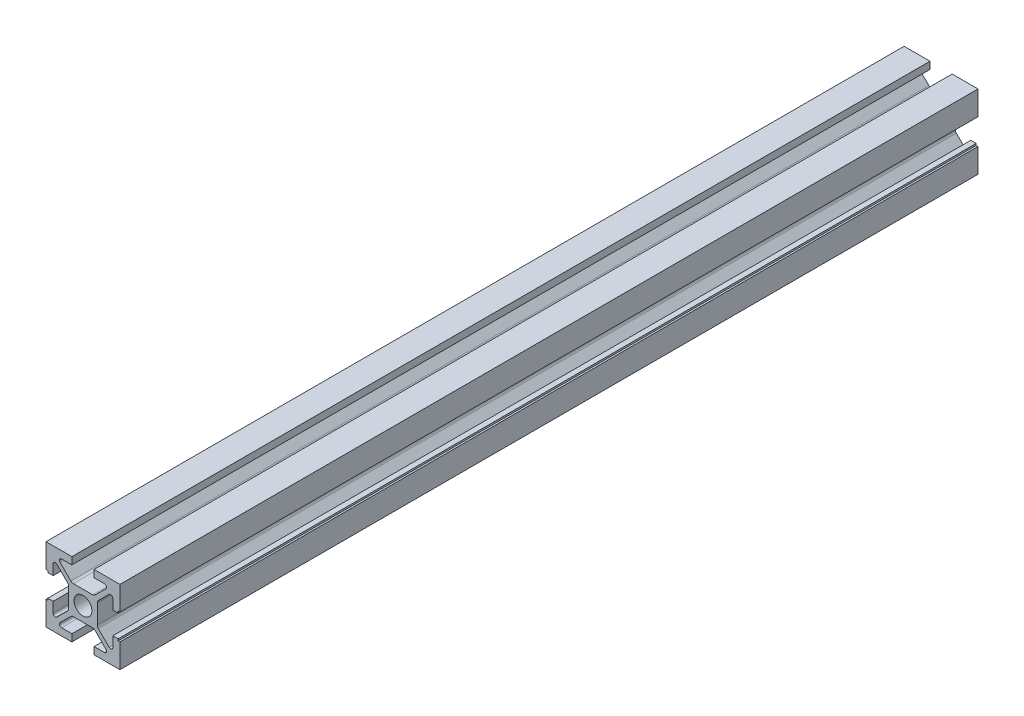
SolidWorks part; units mm, degrees
ref_plane "Front Plane" through (0, 0, 0) normal (0, 0, 1) x (1, 0, 0)
ref_plane "Top Plane" through (0, 0, 0) normal (0, 1, 0) x (1, 0, 0)
ref_plane "Right Plane" through (0, 0, 0) normal (1, 0, 0) x (0, 0, -1)
sketch "Sketch2" plane through (0, 0, 0) normal (0, 0, 1) x (1, 0, 0)
  line L0 (-3.1, 10.3362) -> (3.1, 10.3362) construction
  line L1 (-10.3362, -10.3362) -> (-3.1, -10.3362)
  line L2 (-10.3362, -10.3362) -> (-10.3362, -3.6)
  line L3 (-10.3362, 10.3362) -> (-3.1, 10.3362)
  line L4 (10.3362, -10.3362) -> (10.3362, -3.6)
  line L5 (-10.3362, -10.3362) -> (10.3362, 10.3362) construction
  line L6 (-10.3362, 10.3362) -> (10.3362, -10.3362) construction
  line L7 (-2.6861, -4) -> (2.6861, -4)
  line L8 (-4, -2.686) -> (-4, 3.1)
  line L11 (-4, -4) -> (4, 4) construction
  line L12 (-4, 4) -> (4, -4) construction
  line L13 (-3.1, -10.3362) -> (3.1, -10.3362) construction
  line L14 (3.1, 10.3362) -> (10.3362, 10.3362)
  line L16 (-3.1, -10.3362) -> (-3.1, -8.3362)
  line L17 (-3.1, -4) -> (2.6861, -4)
  line L18 (3.1, -10.3362) -> (3.1, -8.3362)
  line L20 (-3.1, 10.3362) -> (-3.1, 8.3362)
  line L21 (-2.6861, 4) -> (2.6861, 4)
  line L22 (3.1, 10.3362) -> (3.1, 8.3362)
  line L23 (-9.8362, 3.1) -> (-8.3362, 3.1) construction
  line L24 (3.1, -10.3362) -> (10.3362, -10.3362)
  line L25 (-8.3362, 3.1) -> (-8.3362, 10.3362) construction
  line L26 (10.3362, 3.6) -> (10.3362, 10.3362)
  line L27 (-10.3362, 3.6) -> (-10.3362, 10.3362)
  line L28 (-9.8362, -3.1) -> (-8.3362, -3.1)
  line L30 (-9.8362, 3.1) -> (-8.3362, 3.1)
  line L31 (-4, -3.1) -> (-4, 2.686)
  line L32 (9.8362, -3.1) -> (8.3362, -3.1)
  line L34 (9.8362, 3.1) -> (8.3362, 3.1)
  line L35 (4, -2.686) -> (4, 2.686)
  line L36 (-3.1, 10.3362) -> (-3.1, 8.3362) construction
  line L37 (-3.1, 8.3362) -> (-10.3362, 8.3362) construction
  line L38 (-3.3928, 4.2926) -> (-6.4148, 7.3118)
  line L39 (0, 0) -> (0, 4) construction
  line L40 (-7.3118, 6.4142) -> (-4.2926, 3.3928)
  line L41 (-8.3362, 5.9901) -> (-8.3362, 3.1)
  line L42 (-5.9908, 8.3362) -> (-3.1, 8.3362)
  line L43 (3.1, 8.3362) -> (10.3362, 8.3362) construction
  line L44 (3.1, 10.3362) -> (3.1, 8.3362) construction
  line L45 (8.3362, 3.1) -> (8.3362, 10.3362) construction
  line L46 (9.8362, 3.1) -> (8.3362, 3.1) construction
  line L47 (5.9908, 8.3362) -> (3.1, 8.3362)
  line L48 (8.3362, 5.9901) -> (8.3362, 3.1)
  line L49 (7.3118, 6.4142) -> (4.2926, 3.3928)
  line L50 (3.3928, 4.2926) -> (6.4148, 7.3118)
  line L51 (9.8362, 3.1) -> (8.3362, 3.1)
  line L52 (10.3362, 3.6) -> (10.3362, 10.3362)
  line L53 (3.1, 10.3362) -> (3.1, 8.3362)
  line L54 (10.3362, 10.3362) -> (3.1, 10.3362)
  line L55 (-12.9191, 0) -> (12.9191, 0) construction
  line L56 (9.8362, -3.1) -> (8.3362, -3.1) construction
  line L57 (8.3362, -3.1) -> (8.3362, -10.3362) construction
  line L58 (3.1, -10.3362) -> (3.1, -8.3362) construction
  line L59 (3.1, -8.3362) -> (10.3362, -8.3362) construction
  line L60 (-3.1, -8.3362) -> (-10.3362, -8.3362) construction
  line L61 (-3.1, -10.3362) -> (-3.1, -8.3362) construction
  line L62 (-8.3362, -3.1) -> (-8.3362, -10.3362) construction
  line L63 (-9.8362, -3.1) -> (-8.3362, -3.1) construction
  line L64 (-3.1, -10.3362) -> (3.1, -10.3362) construction
  line L65 (10.3362, -10.3362) -> (3.1, -10.3362)
  line L66 (3.1, -10.3362) -> (3.1, -8.3362)
  line L67 (10.3362, -3.6) -> (10.3362, -10.3362)
  line L68 (9.8362, -3.1) -> (8.3362, -3.1)
  line L69 (3.3928, -4.2926) -> (6.4148, -7.3118)
  line L70 (7.3118, -6.4142) -> (4.2926, -3.3928)
  line L71 (8.3362, -5.9901) -> (8.3362, -3.1)
  line L72 (5.9908, -8.3362) -> (3.1, -8.3362)
  line L73 (-5.9908, -8.3362) -> (-3.1, -8.3362)
  line L74 (-8.3362, -5.9901) -> (-8.3362, -3.1)
  line L75 (-7.3118, -6.4142) -> (-4.2926, -3.3928)
  line L76 (-3.3928, -4.2926) -> (-6.4148, -7.3118)
  line L77 (9.8362, -3.1) -> (8.3362, -3.1)
  line L78 (-9.8362, -3.1) -> (-8.3362, -3.1)
  line L79 (-10.3362, -3.6) -> (-10.3362, -10.3362)
  line L80 (10.3362, -3.6) -> (10.3362, -10.3362)
  line L81 (3.1, -10.3362) -> (3.1, -8.3362)
  line L82 (-3.1, -4) -> (3.1, -4)
  line L83 (-3.1, -10.3362) -> (-3.1, -8.3362)
  line L84 (3.1, -10.3362) -> (10.3362, -10.3362)
  line L85 (-10.3362, -10.3362) -> (-3.1, -10.3362)
  line L89 (-10.3362, 3.6) -> (-9.8362, 3.6)
  line L90 (-9.8362, 3.1) -> (-9.8362, 3.6)
  line L93 (10.3362, 3.6) -> (9.8362, 3.6)
  line L94 (9.8362, 3.1) -> (9.8362, 3.6)
  line L97 (-10.3362, -3.6) -> (-9.8362, -3.6)
  line L98 (-9.8362, -3.1) -> (-9.8362, -3.6)
  line L101 (10.3362, -3.6) -> (9.8362, -3.6)
  line L102 (9.8362, -3.1) -> (9.8362, -3.6)
  circle A0 centre (0, 0) radius 2.5
  arc A1 (-7.3118, 6.4142) -> (-8.3362, 5.9901) centre (-7.7362, 5.9901) ccw
  arc A2 (-5.9908, 8.3362) -> (-6.4148, 7.3118) centre (-5.9908, 7.7362) ccw
  arc A3 (5.9908, 8.3362) -> (6.4148, 7.3118) centre (5.9908, 7.7362) cw
  arc A4 (7.3118, 6.4142) -> (8.3362, 5.9901) centre (7.7362, 5.9901) cw
  arc A5 (7.3118, -6.4142) -> (8.3362, -5.9901) centre (7.7362, -5.9901) ccw
  arc A6 (5.9908, -8.3362) -> (6.4148, -7.3118) centre (5.9908, -7.7362) ccw
  arc A7 (-5.9908, -8.3362) -> (-6.4148, -7.3118) centre (-5.9908, -7.7362) cw
  arc A8 (-7.3118, -6.4142) -> (-8.3362, -5.9901) centre (-7.7362, -5.9901) cw
  arc A9 (3.3928, 4.2926) -> (2.6861, 4) centre (2.6861, 5) cw
  arc A10 (-2.6861, 4) -> (-3.3928, 4.2926) centre (-2.6861, 5) cw
  arc A11 (3.3928, -4.2926) -> (2.6861, -4) centre (2.6861, -5) ccw
  arc A12 (-2.6861, -4) -> (-3.3928, -4.2926) centre (-2.6861, -5) ccw
  arc A13 (4.2926, 3.3928) -> (4, 2.686) centre (5, 2.686) ccw
  arc A14 (4.2926, -3.3928) -> (4, -2.686) centre (5, -2.686) cw
  arc A15 (-4, -2.686) -> (-4.2926, -3.3928) centre (-5, -2.686) cw
  arc A16 (-4.2926, 3.3928) -> (-4, 2.686) centre (-5, 2.686) cw
  point P0 (0, 0)
  point P5 (0, 0)
  point P16 (0, 10.3362)
  point P19 (0, -10.3362)
  point P28 (10.3362, 0)
  point P31 (-10.3362, 0)
  point P59 (0, 0)
  point P81 (3.1, 4)
  point P84 (-3.1, 4)
  dimension "D1" = 0.6
  dimension "D2" = 0.6
  dimension "D3" = 1
extrude "Boss-Extrude2" add sketch "Sketch2" along normal blind 240
